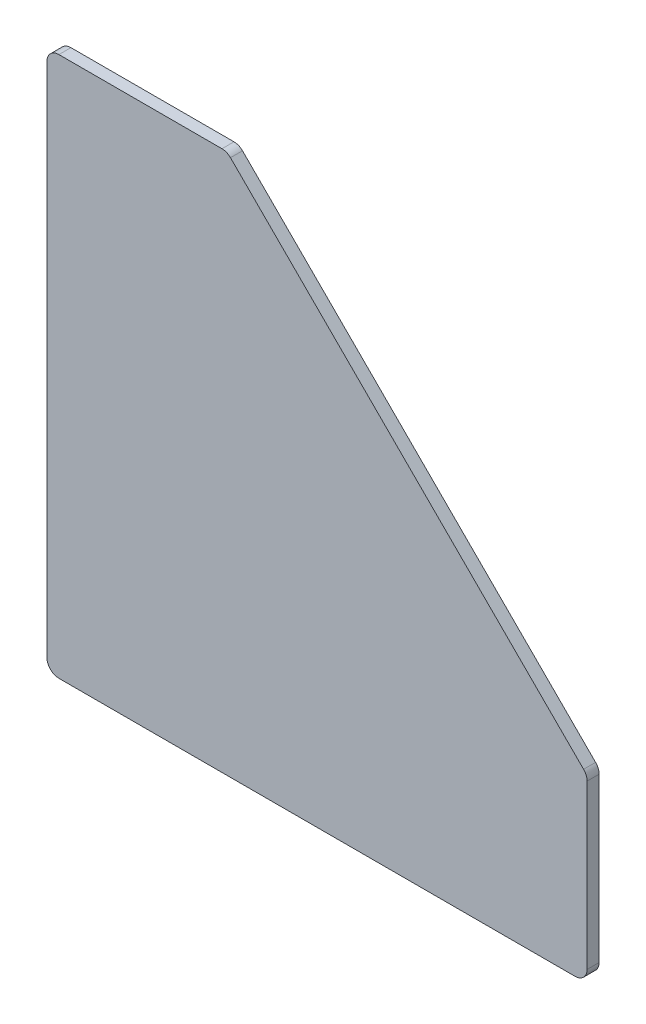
SolidWorks part; units mm, degrees
ref_plane "Plan1" through (0, 0, 0) normal (0, 0, 1) x (1, 0, 0)
ref_plane "Plan2" through (0, 0, 0) normal (0, 1, 0) x (1, 0, 0)
ref_plane "Plan3" through (0, 0, 0) normal (1, 0, 0) x (0, 0, -1)
sketch "Esquisse1" plane through (0, 0, 0) normal (0, 0, 1) x (1, 0, 0)
  line L0 (0, 88) -> (0, 2)
  line L1 (2, 0) -> (88, 0)
  line L2 (90, 2) -> (90, 29.1716)
  line L3 (89.4142, 30.5858) -> (30.5858, 89.4142)
  line L4 (29.1716, 90) -> (2, 90)
  arc A0 (0, 88) -> (2, 90) centre (2, 88) cw
  arc A1 (2, 0) -> (0, 2) centre (2, 2) cw
  arc A2 (88, 0) -> (90, 2) centre (88, 2) ccw
  arc A3 (90, 29.1716) -> (89.4142, 30.5858) centre (88, 29.1716) ccw
  arc A4 (30.5858, 89.4142) -> (29.1716, 90) centre (29.1716, 88) ccw
  point P8 (0, 90)
  point P11 (0, 0)
  point P18 (30, 90)
  dimension "D3" = 2
  dimension "D1" = 30
  dimension "D2" = 90
extrude "Base-Extrusion" add sketch "Esquisse1" along normal blind 2
